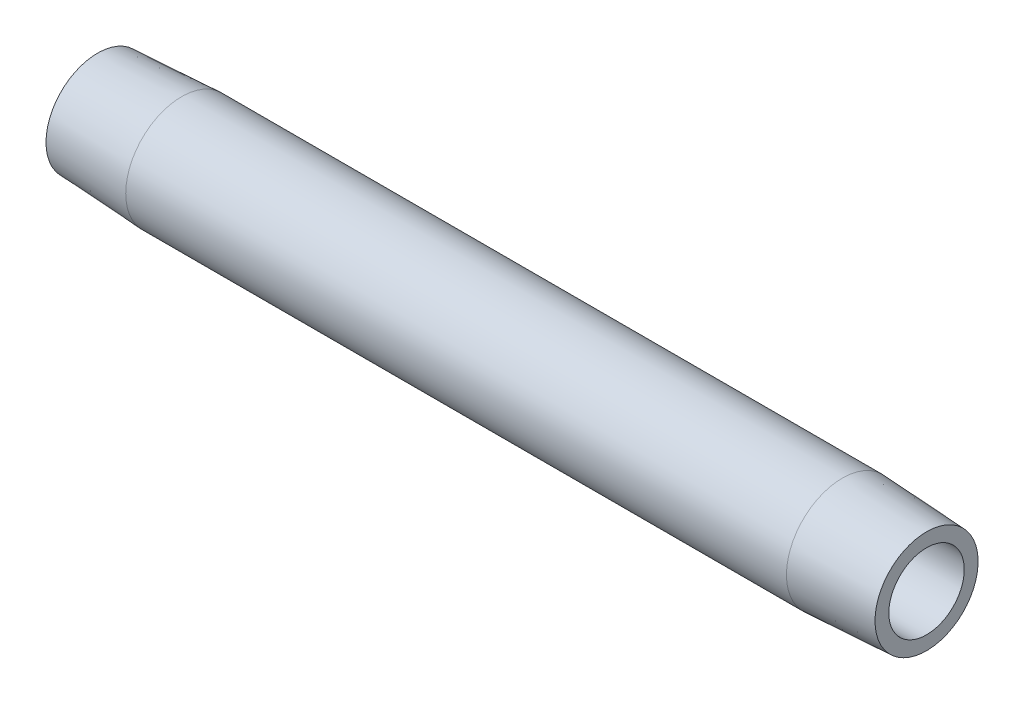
SolidWorks part; units mm, degrees
ref_plane "Front Plane" through (0, 0, 0) normal (0, 0, 1) x (1, 0, 0)
ref_plane "Top Plane" through (0, 0, 0) normal (0, 1, 0) x (1, 0, 0)
ref_plane "Right Plane" through (0, 0, 0) normal (1, 0, 0) x (0, 0, -1)
sketch "Sketch1" plane through (0, 0, 0) normal (0, 1, 0) x (1, 0, 0)
  line L6 (101.6, 4.6228) -> (0, 4.6228)
  line L7 (10.3124, 6.858) -> (0, 6.3175)
  line L8 (0, 6.3175) -> (0, 4.6228)
  line L9 (91.2876, 6.858) -> (10.3124, 6.858)
  line L10 (101.6, 6.3175) -> (91.2876, 6.858)
  line L11 (101.6, 4.6228) -> (101.6, 6.3175)
  line L12 (-6.376, 0) -> (49993.624, 0) construction
  dimension "D1" = 9.2456
  dimension "D2" = 13.716
  dimension "D3" = 3
  dimension "D4" = 3
  dimension "D5" = 101.6
  dimension "D6" = 10.3124
  dimension "D7" = 10.3124
revolve "Revolve1" add sketch "Sketch1" angle 360 about L12
